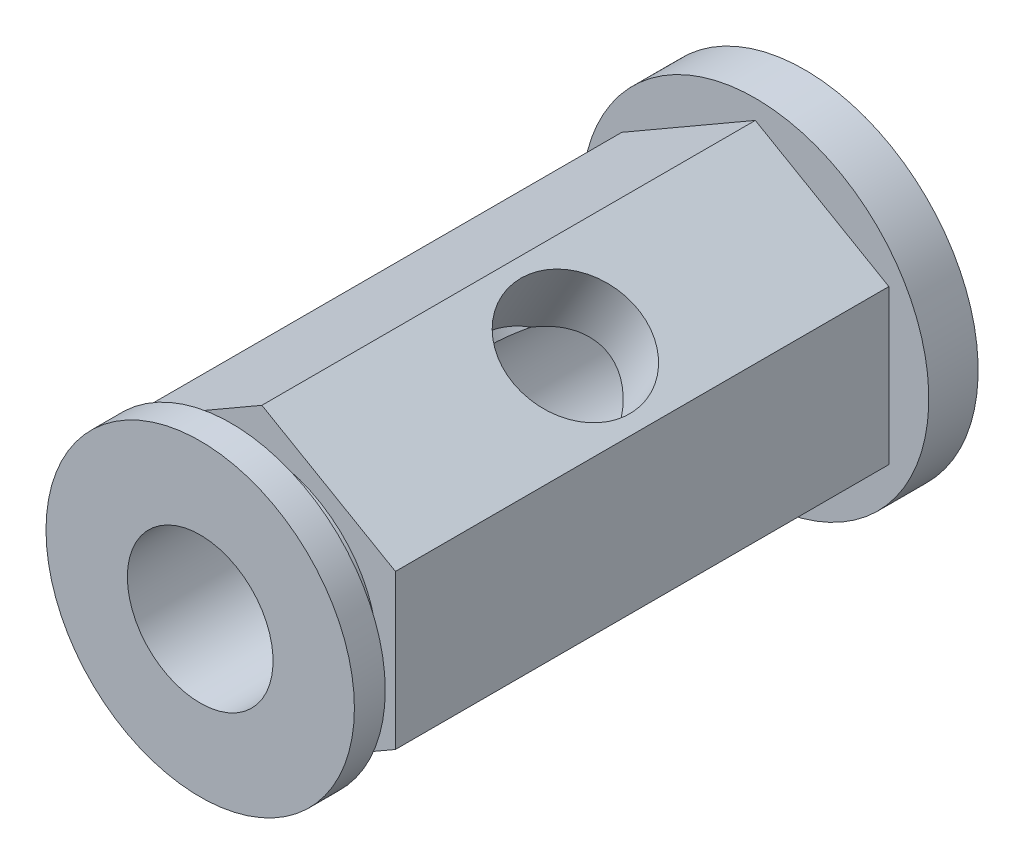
SolidWorks part; units mm, degrees
ref_plane "Front Plane" through (0, 0, 0) normal (0, 0, 1) x (1, 0, 0)
ref_plane "Top Plane" through (0, 0, 0) normal (0, 1, 0) x (1, 0, 0)
ref_plane "Right Plane" through (0, 0, 0) normal (1, 0, 0) x (0, 0, -1)
sketch "Sketch1" plane through (0, 0, 0) normal (0, 0, 1) x (1, 0, 0)
  line L1 (0, 6.35) -> (-5.4993, 3.175)
  line L2 (-5.4993, 3.175) -> (-5.4993, -3.175)
  line L3 (-5.4993, -3.175) -> (0, -6.35)
  line L4 (0, -6.35) -> (5.4993, -3.175)
  line L5 (5.4993, -3.175) -> (5.4993, 3.175)
  line L6 (5.4993, 3.175) -> (0, 6.35)
  circle A0 centre (0, 0) radius 6.35 construction
  dimension "D1" = 12.7
extrude "Boss-Extrude1" add sketch "Sketch1" along normal blind 20.32
sketch "Sketch2" plane through (0, 0, 0) normal (0, 0, -1) x (-1, 0, 0)
  circle A0 centre (0, 0) radius 7.1438
  dimension "D1" = 14.2875
extrude "Boss-Extrude2" add sketch "Sketch2" along normal blind 2.032
sketch "Sketch3" plane through (0, 0, 20.32) normal (0, 0, 1) x (1, 0, 0)
  circle A0 centre (0, 0) radius 4.7386
extrude "Boss-Extrude3" add sketch "Sketch3" along normal blind 1.27
sketch "Sketch4" plane through (0, 0, 21.59) normal (0, 0, 1) x (1, 0, 0)
  circle A0 centre (0, 0) radius 6.35
  dimension "D1" = 12.7
extrude "Boss-Extrude4" add sketch "Sketch4" along normal blind 1.27
sketch "Sketch5" plane through (0, 0, -2.032) normal (0, 0, -1) x (-1, 0, 0)
  circle A0 centre (0, 0) radius 3
  dimension "D1" = 6
extrude "Cut-Extrude1" cut sketch "Sketch5" against normal through all
sketch "Sketch6" plane through (2.7496, 4.7625, 0) normal (0.5, 0.866, 0) x (0.866, -0.5, 0)
  line L0 (0, 0) -> (0, -20.32) construction
  line L1 (3.175, 0) -> (-3.175, 0) construction
  line L2 (3.175, -20.32) -> (-3.175, -20.32) construction
  point P6 (0, -10.16)
hole_wizard "#6 (0.204) Diameter Hole1" positions "Sketch10" profile "Sketch9" hole size "#6" standard "ANSI Inch"
sketch "Sketch10" plane through (2.7496, 4.7625, 0) normal (0.5, 0.866, 0) x (0.866, -0.5, 0)
  point P0 (0, -10.16)
sketch "Sketch9" plane through (2.7496, 4.7625, 10.16) normal (0, 0, 1) x (-0.866, 0.5, 0)
  line L0 (0, 0) -> (0, 4.8587)
  line L1 (0, 4.8587) -> (2.5908, 3.302)
  line L2 (2.5908, 3.302) -> (2.5908, 0)
  line L5 (2.5908, 0) -> (0, 0)
  line L10 (0, 4.8587) -> (-2.5908, 3.302) construction
  line L11 (0, -6.35) -> (0, 107.95) construction
  dimension "Hole Dia." = 5.1816
  dimension "Hole Depth" = 3.302
  dimension "Drill Angle" = 118
